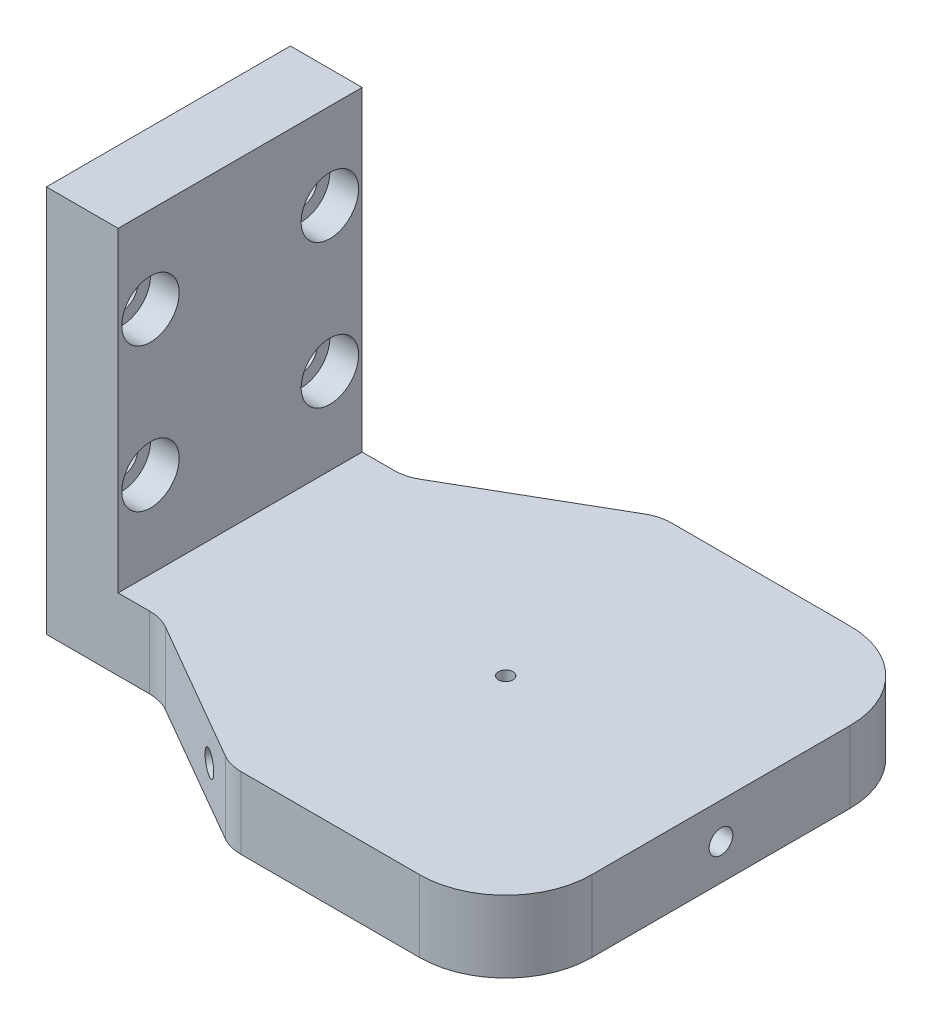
SolidWorks part; units mm, degrees
ref_plane "Front Plane" through (0, 0, 0) normal (0, 0, 1) x (1, 0, 0)
ref_plane "Top Plane" through (0, 0, 0) normal (0, 1, 0) x (1, 0, 0)
ref_plane "Right Plane" through (0, 0, 0) normal (1, 0, 0) x (0, 0, -1)
sketch "Sketch2" plane through (0, 0, 0) normal (0, 1, 0) x (1, 0, 0)
  line L0 (-47, -30) -> (30, -30)
  line L1 (30, -30) -> (30, 30)
  line L2 (30, 30) -> (-47, 30)
  line L3 (-47, 30) -> (-47, -30)
  circle A0 centre (0, 0) radius 1
  dimension "D1" = 2
  dimension "D2" = 30
  dimension "D3" = 30
  dimension "D4" = 47
  dimension "D5" = 30
extrude "Boss-Extrude1" add sketch "Sketch2" along normal blind 10
sketch "Sketch3" plane through (0, 10, 0) normal (0, 1, 0) x (1, 0, 0)
  line L0 (-47, 30) -> (-47, -30) construction
  line L1 (-47, -17) -> (-37, -17)
  line L2 (-47, -17) -> (-47, 17)
  line L3 (-47, 17) -> (-37, 17)
  line L4 (-37, -17) -> (-37, 17)
  line L5 (30, 30) -> (-47, 30) construction
  dimension "D1" = 10
  dimension "D2" = 13
  dimension "D3" = 34
extrude "Boss-Extrude2" add sketch "Sketch3" along normal blind 44
sketch "Sketch4" plane through (0, 10, 0) normal (0, 1, 0) x (1, 0, 0)
  line L0 (0, 0) -> (-20.9398, 36.2689) construction
  line L1 (0, 0) -> (-23.1843, -40.1563) construction
  line L2 (30, 30) -> (-47, 30) construction
  line L3 (-47, 17) -> (-31, 17)
  line L4 (-31, 17) -> (-8.4833, 30)
  line L5 (-8.4833, 30) -> (-47, 30)
  line L6 (-47, 30) -> (-47, 17)
  line L7 (-47, -17) -> (-31, -17)
  line L8 (-31, -17) -> (-8.4833, -30)
  line L9 (-47, -30) -> (30, -30) construction
  line L10 (-8.4833, -30) -> (-47, -30)
  line L11 (-47, -30) -> (-47, -17)
  dimension "D1" = 120
  dimension "D2" = 120
  dimension "D3" = 150
  dimension "D4" = 16
  dimension "D5" = 16
  dimension "D6" = 150
extrude "Cut-Extrude1" cut sketch "Sketch4" against normal through all
hole_wizard "M4x0.7 Tapped Hole1" positions "Sketch6" profile "Sketch5" tap size "M4x0.7" standard "ANSI Metric"
sketch "Sketch6" plane through (-15.1112, 0, -26.1734) normal (-0.5, 0, -0.866) x (-0.866, 0, 0.5)
  line L0 (0, 10) -> (0, 0) construction
  line L1 (18.3468, 0) -> (-7.6532, 0) construction
  point P0 (0, 5)
  dimension "D1" = 5
sketch "Sketch5" plane through (-15.1112, 5, -26.1734) normal (0, 1, 0) x (-0.866, 0, 0.5)
  line L0 (0, 0) -> (0, 29.2224)
  line L1 (0, 29.2224) -> (1.65, 29.2224)
  line L2 (1.65, 29.2224) -> (1.65, 0)
  line L5 (1.65, 0) -> (0, 0)
  line L11 (0, -6.35) -> (0, 107.95) construction
  dimension "Thru Tap Drill Dia." = 3.3
  dimension "Thru Tap Drill Depth" = 29.2224
hole_wizard "M4x0.7 Tapped Hole2" positions "Sketch8" profile "Sketch7" tap size "M4x0.7" standard "ANSI Metric"
sketch "Sketch8" plane through (-15.1112, 0, 26.1734) normal (-0.5, 0, 0.866) x (0.866, 0, 0.5)
  line L0 (0, 10) -> (0, 0) construction
  line L1 (7.6532, 0) -> (-18.3468, 0) construction
  point P0 (0, 5)
  dimension "D1" = 5
sketch "Sketch7" plane through (-15.1112, 5, 26.1734) normal (0, 1, 0) x (0.866, 0, 0.5)
  line L0 (0, 0) -> (0, 29.2224)
  line L1 (0, 29.2224) -> (1.65, 29.2224)
  line L2 (1.65, 29.2224) -> (1.65, 0)
  line L5 (1.65, 0) -> (0, 0)
  line L11 (0, -6.35) -> (0, 107.95) construction
  dimension "Thru Tap Drill Dia." = 3.3
  dimension "Thru Tap Drill Depth" = 29.2224
hole_wizard "M4x0.7 Tapped Hole3" positions "Sketch10" profile "Sketch9" tap size "M4x0.7" standard "ANSI Metric"
sketch "Sketch10" plane through (30, 0, 0) normal (1, 0, 0) x (0, 0, -1)
  line L0 (0, 10) -> (0, 0) construction
  line L1 (-30, 0) -> (30, 0) construction
  point P0 (0, 5)
  dimension "D1" = 5
sketch "Sketch9" plane through (30, 5, 0) normal (0, 1, 0) x (0, 0, -1)
  line L0 (0, 0) -> (0, 29)
  line L1 (0, 29) -> (1.65, 29)
  line L2 (1.65, 29) -> (1.65, 0)
  line L5 (1.65, 0) -> (0, 0)
  line L11 (0, -6.35) -> (0, 107.95) construction
  dimension "Thru Tap Drill Dia." = 3.3
  dimension "Thru Tap Drill Depth" = 29
fillet "Fillet1" radius 6 2 edges at (-31, 5, 17) (-31, 5, -17)
fillet "Fillet2" radius 6 2 edges at (-8.4833, 5, -30) (-8.4833, 5, 30)
fillet "Fillet3" radius 12 2 edges at (30, 5, -30) (30, 5, 30)
hole_wizard "CBORE for M4 SHCS1" positions "Sketch12" profile "Sketch11" counterbore size "M4" standard "ANSI Metric"
sketch "Sketch12" plane through (-37, 0, 0) normal (1, 0, 0) x (0, 0, -1)
  point P0 (-12.5, 42)
  point P3 (12.5, 42)
  point P6 (12.5, 22)
  point P9 (-12.5, 22)
sketch "Sketch11" plane through (-37, 42, 12.5) normal (0, 1, 0) x (0, 0, -1)
  line L0 (0, 0) -> (0, 10)
  line L1 (0, 10) -> (2.25, 10)
  line L3 (2.25, 10) -> (2.25, 4)
  line L4 (2.25, 4) -> (4, 4)
  line L5 (4, 4) -> (4, 0)
  line L7 (4, 0) -> (0, 0)
  line L11 (0, -6.35) -> (0, 107.95) construction
  dimension "Thru Hole Dia." = 4.5
  dimension "Thru Hole Depth" = 10
  dimension "C'Bore Dia." = 8
  dimension "C'Bore Depth" = 4
